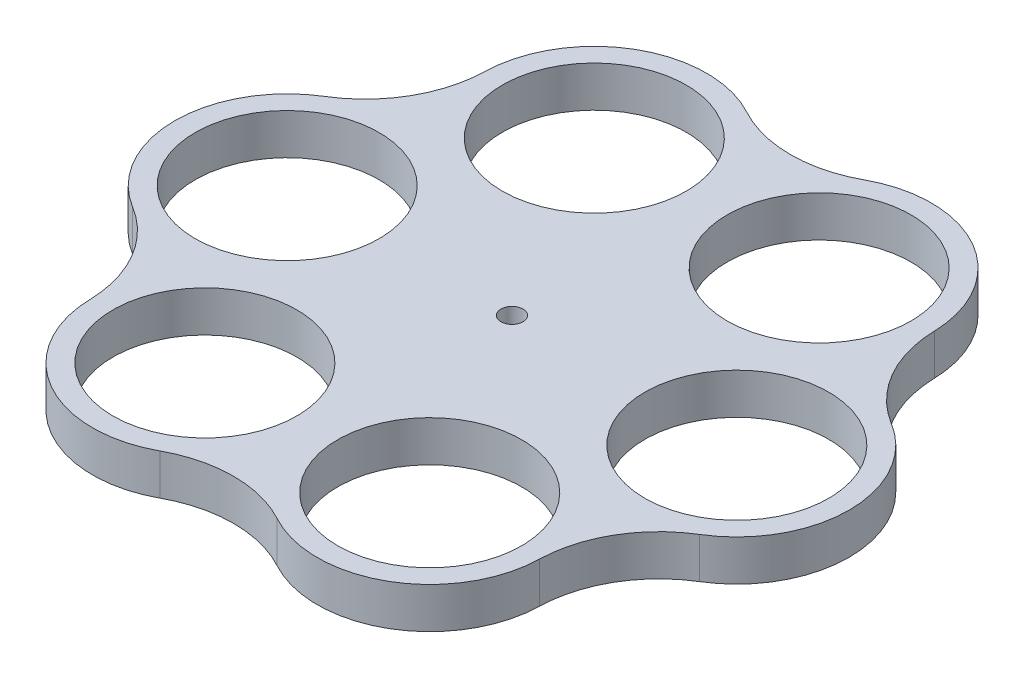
SolidWorks part; units mm, degrees
ref_plane "Front Plane" through (0, 0, 0) normal (0, 0, 1) x (1, 0, 0)
ref_plane "Top Plane" through (0, 0, 0) normal (0, 1, 0) x (1, 0, 0)
ref_plane "Right Plane" through (0, 0, 0) normal (1, 0, 0) x (0, 0, -1)
sketch "Sketch1" plane through (0, 0, 0) normal (0, 1, 0) x (1, 0, 0)
  line L3 (-27.5, 0) -> (-32.5, 0)
  circle A0 centre (27.5, 47.6314) radius 22.5
  circle A1 centre (-27.5, 47.6314) radius 22.5
  circle A2 centre (-55, 0) radius 22.5
  circle A3 centre (-27.5, -47.6314) radius 22.5
  circle A4 centre (27.5, -47.6314) radius 22.5
  circle A5 centre (55, 0) radius 22.5
  arc A6 (54.9915, 48.3168) -> (14.3478, 71.7824) centre (27.5, 47.6314) ccw
  arc A7 (-14.3478, 71.7824) -> (-54.9915, 48.3168) centre (-27.5, 47.6314) ccw
  arc A8 (-69.3393, 23.4656) -> (-69.3393, -23.4656) centre (-55, 0) ccw
  arc A9 (-54.9915, -48.3168) -> (-14.3478, -71.7824) centre (-27.5, -47.6314) ccw
  arc A10 (14.3478, -71.7824) -> (54.9915, -48.3168) centre (27.5, -47.6314) ccw
  arc A11 (69.3393, -23.4656) -> (69.3393, 23.4656) centre (55, 0) ccw
  arc A12 (54.9915, 48.3168) -> (69.3393, 23.4656) centre (84.9821, 49.0645) ccw
  arc A13 (-14.3478, 71.7824) -> (14.3478, 71.7824) centre (0, 98.1289) ccw
  arc A14 (-69.3393, 23.4656) -> (-54.9915, 48.3168) centre (-84.9821, 49.0645) ccw
  arc A15 (-54.9915, -48.3168) -> (-69.3393, -23.4656) centre (-84.9821, -49.0645) ccw
  arc A16 (14.3478, -71.7824) -> (-14.3478, -71.7824) centre (0, -98.1289) ccw
  arc A17 (69.3393, -23.4656) -> (54.9915, -48.3168) centre (84.9821, -49.0645) ccw
  circle A18 centre (0, 0) radius 2.7
extrude "Boss-Extrude1" add sketch "Sketch1" along normal blind 10
